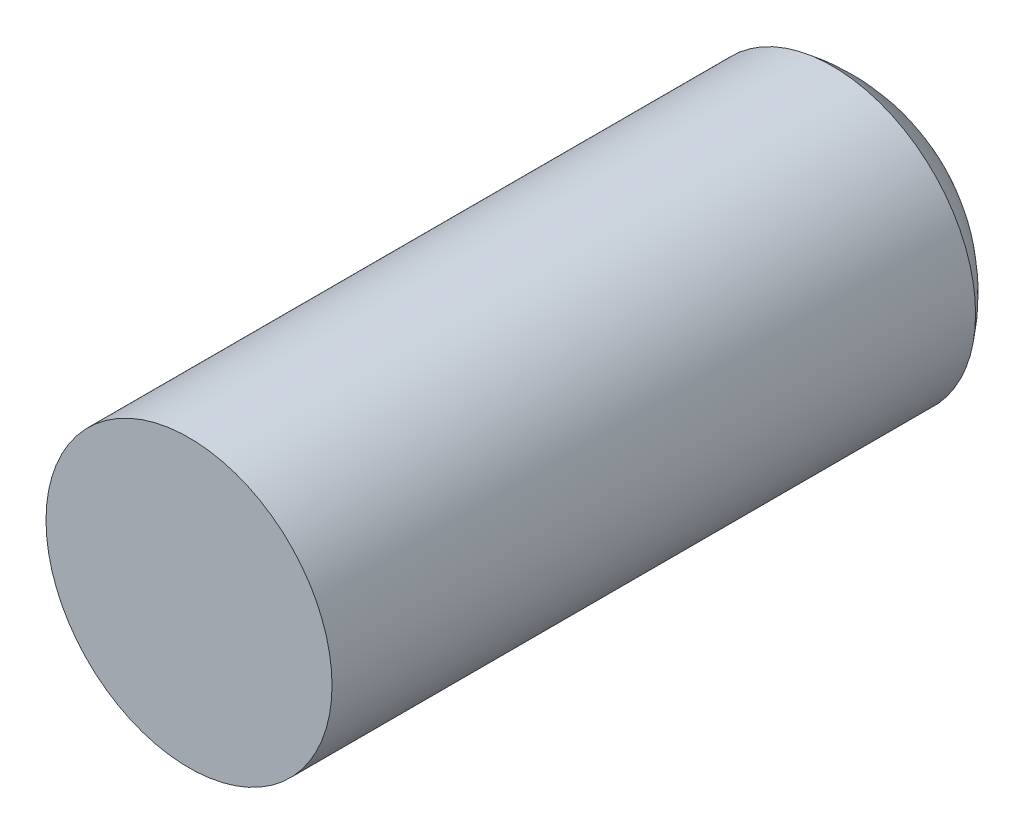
SolidWorks part; units mm, degrees
ref_plane "正面" through (0, 0, 0) normal (0, 0, 1) x (1, 0, 0)
ref_plane "平面" through (0, 0, 0) normal (0, 1, 0) x (1, 0, 0)
ref_plane "右側面" through (0, 0, 0) normal (1, 0, 0) x (0, 0, -1)
sketch "ｽｹｯﾁ1" plane through (0, 0, 0) normal (0, 0, 1) x (1, 0, 0)
  circle A0 centre (0, 0) radius 2
  dimension "D1" = 4
extrude "ﾎﾞｽ - 押し出し1" add sketch "ｽｹｯﾁ1" against normal blind 10
sketch "s-先端形状" plane through (0, 0, 0) normal (1, 0, 0) x (0, 0, -1)
  line L0 (9, 2) -> (9, -2) construction
  line L1 (10, 2) -> (0, 2) construction
  line L2 (0, -2) -> (10, -2) construction
  line L3 (10, -2) -> (10, 2) construction
  arc A0 (9, -2) -> (9, 2) centre (7.5, 0) ccw
  dimension "D1" = 1
sketch "ｽｹｯﾁ3" plane through (0, 0, 0) normal (1, 0, 0) x (0, 0, -1)
  arc A0 (9, -2) -> (9, 2) centre (7.5, 0) ccw construction
  arc A1 (9, -2) -> (10, 0) centre (7.5, 0) ccw
other "ｶｯﾄ-回転-薄板1" parameters "D1"=360, "D3"=10, "D4"=10, "D7"=0
